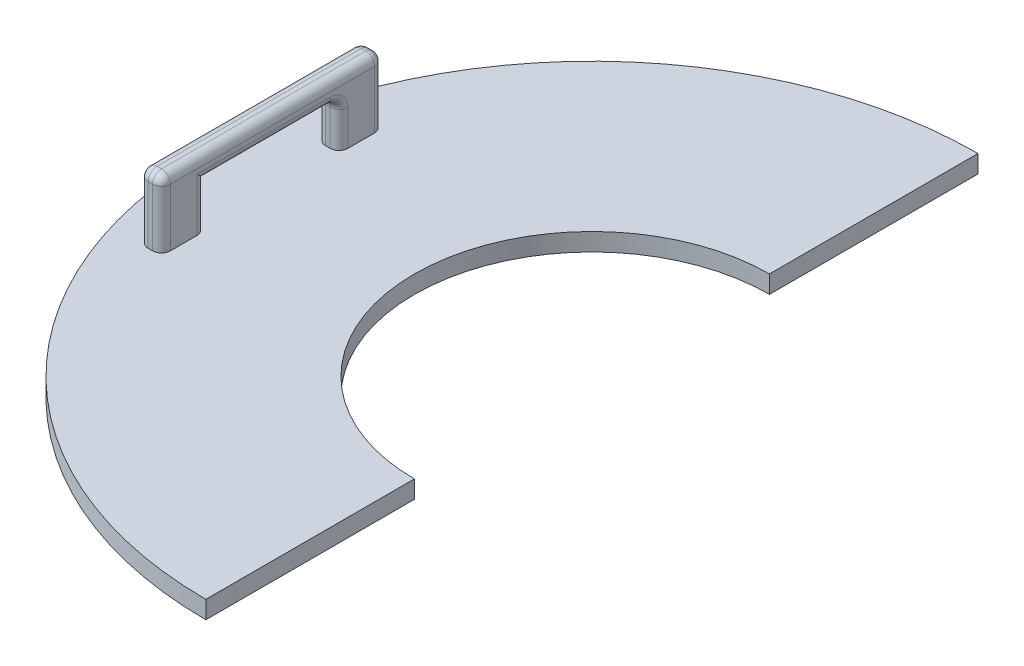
SolidWorks part; units mm, degrees
ref_plane "Front Plane" through (0, 0, 0) normal (0, 0, 1) x (1, 0, 0)
ref_plane "Top Plane" through (0, 0, 0) normal (0, 1, 0) x (1, 0, 0)
ref_plane "Right Plane" through (0, 0, 0) normal (1, 0, 0) x (0, 0, -1)
sketch "Sketch1" plane through (0, 0, 0) normal (0, 1, 0) x (1, 0, 0)
  line L0 (0, 87) -> (0, 40)
  line L1 (0, -40) -> (0, -87)
  arc A0 (0, 40) -> (0, -40) centre (0, 0) ccw
  arc A1 (0, 87) -> (0, -87) centre (0, 0) ccw
  dimension "D1" = 174
  dimension "D2" = 80
extrude "Boss-Extrude1" add sketch "Sketch1" along normal blind 4
sketch "Sketch2" plane through (0, 4, 0) normal (0, 1, 0) x (1, 0, 0)
  line L0 (0, 0) -> (-87, 0) construction
  line L1 (-77, -25) -> (-72, -25)
  line L2 (-77, -25) -> (-77, -15)
  line L3 (-77, -15) -> (-72, -15)
  line L4 (-72, -25) -> (-72, -15)
  line L5 (-77, 15) -> (-72, 15)
  line L6 (-77, 15) -> (-77, 25)
  line L7 (-77, 25) -> (-72, 25)
  line L8 (-72, 15) -> (-72, 25)
  arc A1 (0, 87) -> (0, -87) centre (0, 0) ccw construction
  dimension "D1" = 15
  dimension "D2" = 15
  dimension "D3" = 10
  dimension "D4" = 5
  dimension "D5" = 10
extrude "Boss-Extrude2" add sketch "Sketch2" along normal blind 15
sketch "Sketch3" plane through (0, 0, -15) normal (0, 0, 1) x (1, 0, 0)
  line L0 (-72, 19) -> (-72, 4) construction
  line L1 (-77, 19) -> (-72, 19)
  line L2 (-77, 19) -> (-77, 14)
  line L3 (-77, 14) -> (-72, 14)
  line L4 (-72, 19) -> (-72, 14)
  dimension "D1" = 5
extrude "Boss-Extrude3" add sketch "Sketch3" along normal up to next
fillet "Fillet1" radius 2 15 edges at (-72, 14, 0) (-77, 9, -15) (-77, 9, 15) (-72, 9, 15) (-72, 9, -15) (-74.5, 14, -15) (-77, 14, 0) (-72, 19, 0) (-77, 19, 0) (-74.5, 19, 25) (-74.5, 19, -25) (-72, 11.5, -25) (-77, 11.5, -25) (-72, 11.5, 25) (-77, 11.5, 25)
